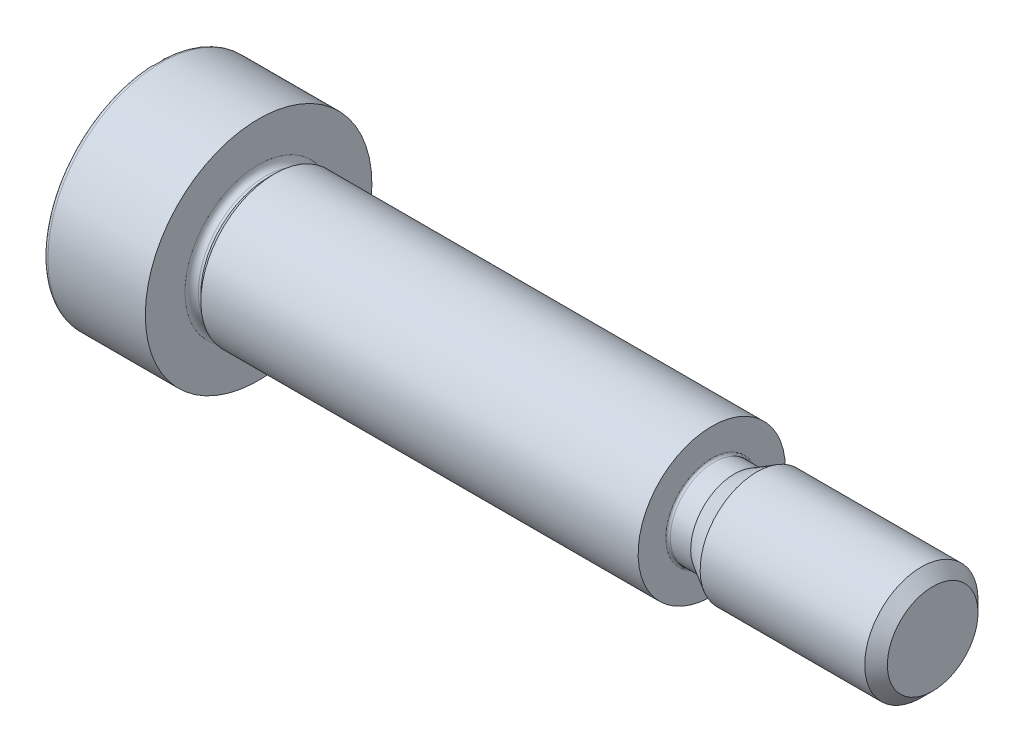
SolidWorks part; units mm, degrees
ref_plane "Front" through (0, 0, 0) normal (0, 0, 1) x (1, 0, 0)
ref_plane "Top" through (0, 0, 0) normal (0, 1, 0) x (1, 0, 0)
ref_plane "Right" through (0, 0, 0) normal (1, 0, 0) x (0, 0, -1)
sketch "Sketch1" plane through (0, 0, 0) normal (1, 0, 0) x (0, 0, -1)
  circle A0 centre (0, 0) radius 5
extrude "BaseHead" add sketch "Sketch1" along normal blind 4.5
sketch "Sketch2" plane through (4.5, 0, 0) normal (1, 0, 0) x (0, 0, -1)
  circle A0 centre (0, 0) radius 3.25
  dimension "ds" = 6.5
extrude "BaseBody" add sketch "Sketch2" along normal blind 20
sketch "Sketch3" plane through (24.5, 0, 0) normal (1, 0, 0) x (0, 0, -1)
  circle A0 centre (0, 0) radius 2.5
  dimension "d" = 5
extrude "BaseEnd" add sketch "Sketch3" along normal blind 9.75
sketch "Sketch4" plane through (-14.7581, 7.8281, 0) normal (0, 0, 1) x (0, -1, 0)
  line L0 (7.8281, 27.7861) -> (7.8281, 17.3801) construction
  line L1 (0.8981, 40.2581) -> (3.8981, 40.2581)
  line L2 (0.8981, 40.2581) -> (0.8981, 39.2581)
  line L3 (0.8981, 39.2581) -> (5.8981, 39.2581)
  line L4 (5.8981, 40.2581) -> (5.8981, 39.2581)
  line L7 (5.8981, 40.2581) -> (3.8981, 43.7222)
  line L8 (3.8981, 43.7222) -> (3.8981, 40.2581)
  line L9 (11.0781, 39.2581) -> (4.5781, 39.2581) construction
  dimension "D1" = 30
  dimension "g2" = 1
  dimension "D2" = 2
  dimension "dg2" = 3.86
  dimension "D3" = 5
revolve "Cut-Revolve2" cut sketch "Sketch4" angle 360 about L0
fillet "Fillet1" radius 0.1 1 edges at (24.5, 1.93, 0)
sketch "Sketch5" plane through (0, 0, 0) normal (1, 0, 0) x (0, 0, -1)
  line L1 (1.7321, 0) -> (0.866, 1.5)
  line L2 (0.866, 1.5) -> (-0.866, 1.5)
  line L3 (-0.866, 1.5) -> (-1.7321, 0)
  line L4 (-1.7321, 0) -> (-0.866, -1.5)
  line L5 (-0.866, -1.5) -> (0.866, -1.5)
  line L6 (0.866, -1.5) -> (1.7321, 0)
  circle A0 centre (0, 0) radius 1.5 construction
  dimension "s" = 3
extrude "Socket" cut sketch "Sketch5" along normal blind 2.4
sketch "Sketch6" plane through (2.4, 0, 0) normal (-1, 0, 0) x (0, 0, 1)
  line L0 (1.7321, 0) -> (0.866, -1.5) construction
  line L1 (0.866, -1.5) -> (-0.866, -1.5) construction
  line L2 (-0.866, -1.5) -> (-1.7321, 0) construction
  line L3 (0.866, 1.5) -> (1.7321, 0) construction
  line L4 (-1.7321, 0) -> (-0.866, 1.5) construction
  line L5 (-0.866, 1.5) -> (0.866, 1.5) construction
  line L6 (1.7321, 0) -> (0.866, -1.5)
  line L7 (0.866, -1.5) -> (-0.866, -1.5)
  line L8 (-0.866, -1.5) -> (-1.7321, 0)
  line L9 (0.866, 1.5) -> (1.7321, 0)
  line L10 (-1.7321, 0) -> (-0.866, 1.5)
  line L11 (-0.866, 1.5) -> (0.866, 1.5)
extrude "Cut-Extrude2" cut sketch "Sketch6" against normal blind 10 draft 60
sketch "Sketch7" plane through (-6.2703, -1.6897, 0) normal (0, 0, 1) x (0, -1, 0)
  line L1 (-9.6497, 10.7703) -> (-4.9497, 10.7703)
  line L2 (-9.6497, 10.7703) -> (-9.6497, 11.1805)
  line L3 (-9.6497, 11.1805) -> (-7.6497, 11.1805)
  line L4 (-4.6497, 11.0703) -> (-4.6497, 11.1805)
  line L5 (-1.6897, 18.8023) -> (-1.6897, 7.3187) construction
  line L7 (-4.6497, 11.1805) -> (-6.6497, 13.1805)
  line L8 (-6.6497, 13.1805) -> (-7.6497, 13.1805)
  line L9 (-7.6497, 13.1805) -> (-7.6497, 11.1805)
  line L10 (3.3103, 10.7703) -> (-6.6897, 10.7703) construction
  arc A0 (-4.9497, 10.7703) -> (-4.6497, 11.0703) centre (-4.9497, 11.0703) ccw
  dimension "r1" = 0.3
  dimension "D1" = 45
  dimension "dg1" = 5.92
  dimension "D2" = 5
  dimension "g1" = 0.4102
  dimension "D3" = 2
  dimension "D4" = 1
revolve "Neck" cut sketch "Sketch7" angle 360 about L5
chamfer "Chamfer1" distance 0.5 angle 45 1 edges at (34.25, 0, -2.5)
fillet "HeadFillet" radius 0.2 1 edges at (0, 0, -5)
sketch "Sketch8" plane through (0, 0, 0) normal (0, 0, 1) x (1, 0, 0)
  line L0 (33.75, 2.2835) -> (33.875, 2.5)
  line L1 (33.875, 2.5) -> (33.875, 2.75)
  line L2 (33.875, 2.75) -> (33.625, 2.75)
  line L3 (33.625, 2.75) -> (33.625, 2.5)
  line L4 (33.625, 2.5) -> (33.75, 2.2835)
  line L5 (33.75, -2.5) -> (33.75, 2.5) construction
  line L6 (0, 0) -> (37.4968, 0) construction
  dimension "D1" = 5
  dimension "D2" = 0.25
revolve "Cut-Revolve10" [suppressed] cut sketch "Sketch8" angle 360 about L6
pattern_linear "LPattern10" [suppressed] count 29 spacing 0.3 along (1, 0, 0)
equation "\"D1@Sketch8\" = \"d@Sketch3\""
equation "\"D2@Sketch8\" =  ( \"d@Sketch3\" - \"THD_MINOR@ThreadCosmetic1\" )  / 2"
equation "\"D3@LPattern10\" = \"D2@Sketch8\" * 1.2"
equation "\"D1@LPattern10\" =  ( \"b@BaseEnd\" - \"g2@Sketch4\" )  / \"D3@LPattern10\""
